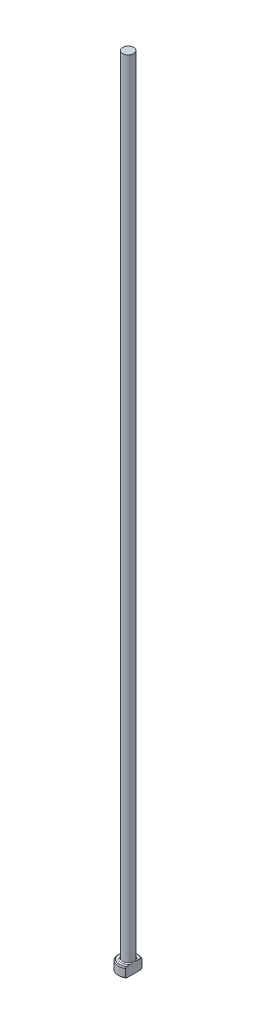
SolidWorks part; units mm, degrees
ref_plane "Front Plane" through (0, 0, 0) normal (0, 0, 1) x (1, 0, 0)
ref_plane "Top Plane" through (0, 0, 0) normal (0, 1, 0) x (1, 0, 0)
ref_plane "Right Plane" through (0, 0, 0) normal (1, 0, 0) x (0, 0, -1)
sketch "Sketch1" plane through (0, 0, 0) normal (0, 0, 1) x (1, 0, 0)
  line L0 (0, 259.9588) -> (0, -15.1925) construction
  line L1 (0, 0) -> (-2, 0)
  line L2 (-2, 0) -> (-2, 2)
  line L3 (-2, 2) -> (-1.1, 2)
  line L4 (-1.1, 2) -> (-1.1, 160)
  line L5 (-1.1, 160) -> (0, 160)
  line L6 (0, 160) -> (0, 0)
  dimension "L" = 160
  dimension "H" = 4
  dimension "T" = 2
  dimension "D" = 2.2
revolve "Revolve1" add sketch "Sketch1" angle 360 about L0
chamfer "Chamfer1" distance 0.2 angle 45 2 edges at (0, 2, 2) (0, 0, 2)
fillet "Fillet1" radius 0.2 1 edges at (0, 2, 1.1)
sketch "Sketch2" plane through (0, 0, 0) normal (0, 1, 0) x (1, 0, 0)
  line L0 (1.1, 1.6703) -> (1.1, -1.6703)
  circle A0 centre (0, 0) radius 2 construction
  arc A1 (1.1, -1.6703) -> (1.1, 1.6703) centre (0, 0) ccw
  circle A2 centre (0, 0) radius 1.1 construction
extrude "KEY" cut sketch "Sketch2" along normal through all
